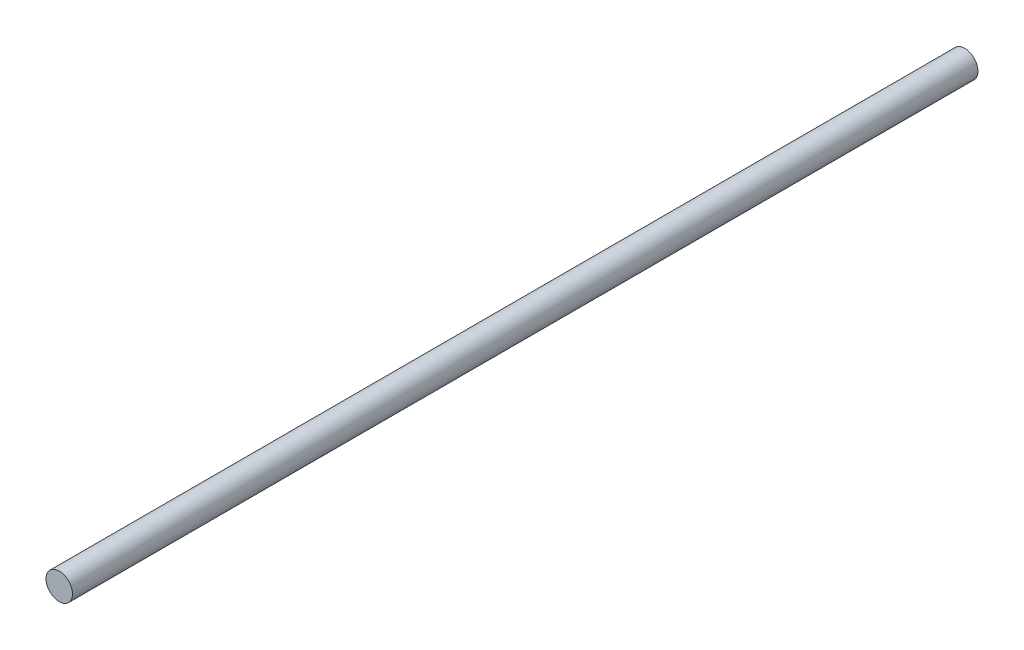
SolidWorks part; units mm, degrees
ref_plane "Front Plane" through (0, 0, 0) normal (0, 0, 1) x (1, 0, 0)
ref_plane "Top Plane" through (0, 0, 0) normal (0, 1, 0) x (1, 0, 0)
ref_plane "Right Plane" through (0, 0, 0) normal (1, 0, 0) x (0, 0, -1)
sketch "Sketch1" plane through (0, 0, 0) normal (0, 0, 1) x (1, 0, 0)
  circle A0 centre (0, 0) radius 30
  dimension "D1" = 60
extrude "Boss-Extrude1" add sketch "Sketch1" against normal blind 2050
